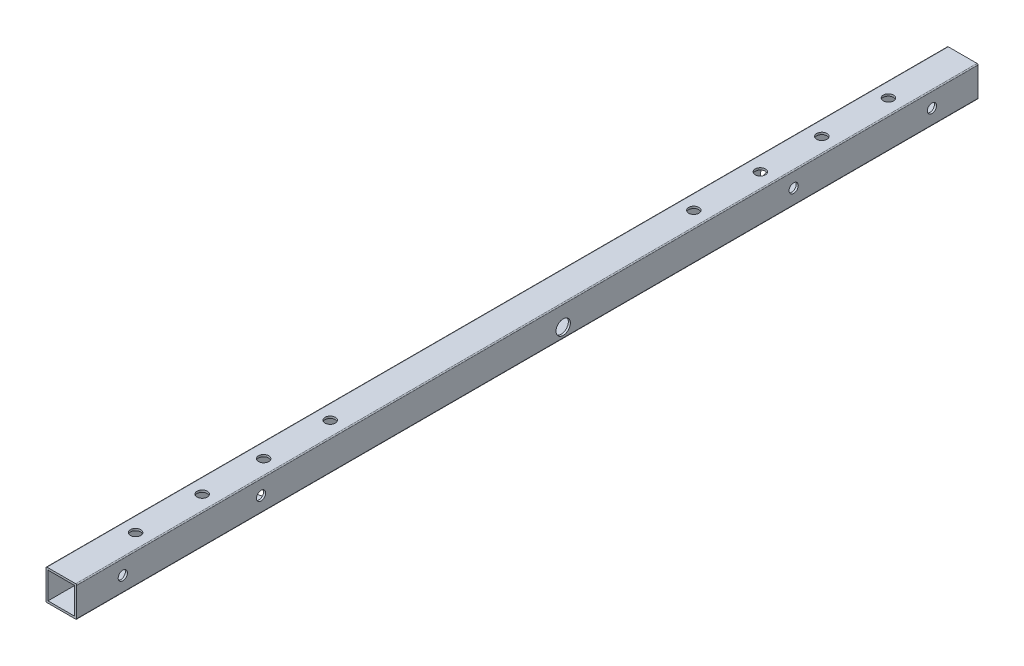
SolidWorks part; units mm, degrees
ref_plane "Plan1" through (0, 0, 0) normal (0, 0, 1) x (1, 0, 0)
ref_plane "Plan2" through (0, 0, 0) normal (0, 1, 0) x (1, 0, 0)
ref_plane "Plan3" through (0, 0, 0) normal (1, 0, 0) x (0, 0, -1)
sketch "Esquisse1" plane through (0, 0, 0) normal (0, 0, 1) x (1, 0, 0)
  line L0 (-14, 15) -> (14, 15)
  line L1 (-15, 14) -> (-15, -14)
  line L2 (14, -15) -> (-14, -15)
  line L3 (15, -14) -> (15, 14)
  line L4 (14, 14) -> (-14, -14) construction
  arc A0 (-14, -15) -> (-15, -14) centre (-14, -14) cw
  arc A1 (-15, 14) -> (-14, 15) centre (-14, 14) cw
  arc A2 (15, 14) -> (14, 15) centre (14, 14) ccw
  arc A3 (15, -14) -> (14, -15) centre (14, -14) cw
  dimension "D1" = 1
  dimension "D2" = 30
extrude "Base-Extru.-Mince" add sketch "Esquisse1" along normal blind 880 thin
sketch "Esquisse2" plane through (0, 15, 0) normal (0, 1, 0) x (-1, 0, 0)
  line L1 (15, 880) -> (15, 0) construction
  circle A0 centre (0, 72.5) radius 5
  circle A1 centre (0, 137.5) radius 5
  circle A2 centre (0, 742.5) radius 5
  circle A3 centre (0, 807.5) radius 5
  circle A4 centre (0, 197.5) radius 5
  circle A5 centre (0, 262.5) radius 5
  circle A6 centre (0, 617.5) radius 5
  circle A7 centre (0, 682.5) radius 5
  dimension "D1" = 10
  dimension "D2" = 15
  dimension "D3" = 65
  dimension "D4" = 65
  dimension "D5" = 605
  dimension "D6" = 72.5
  dimension "D7" = 65
  dimension "D8" = 65
  dimension "D9" = 355
  dimension "D10" = 197.5
extrude "Enlèv. mat.-Extru.1" cut sketch "Esquisse2" against normal blind 35
sketch "Esquisse3" plane through (-15, 0, 0) normal (-1, 0, 0) x (0, 0, 1)
  line L0 (880, 15) -> (0, 15) construction
  line L2 (880, -15) -> (0, -15) construction
  line L3 (880, 14) -> (880, -14) construction
  circle A0 centre (835, 0) radius 4.5
  circle A1 centre (700, 0) radius 4.5
  circle A2 centre (45, 0) radius 4.5
  circle A3 centre (180, 0) radius 4.5
  circle A4 centre (405, -5) radius 4.5
  dimension "D1" = 9
  dimension "D7" = 9
  dimension "D2" = 135
  dimension "D3" = 135
  dimension "D4" = 45
  dimension "D5" = 15
  dimension "D6" = 45
  dimension "D8" = 405
  dimension "D9" = 20
extrude "Enlèv. mat.-Extru.2" cut sketch "Esquisse3" against normal through all
sketch "Esquisse4" plane through (15, 0, 0) normal (1, 0, 0) x (0, 0, -1)
  circle A0 centre (-405, -5) radius 7
  dimension "D1" = 14
extrude "Enlèv. mat.-Extru.3" cut sketch "Esquisse4" against normal blind 10
equation "\"D4@Esquisse2\" = \"D3@Esquisse2\""
